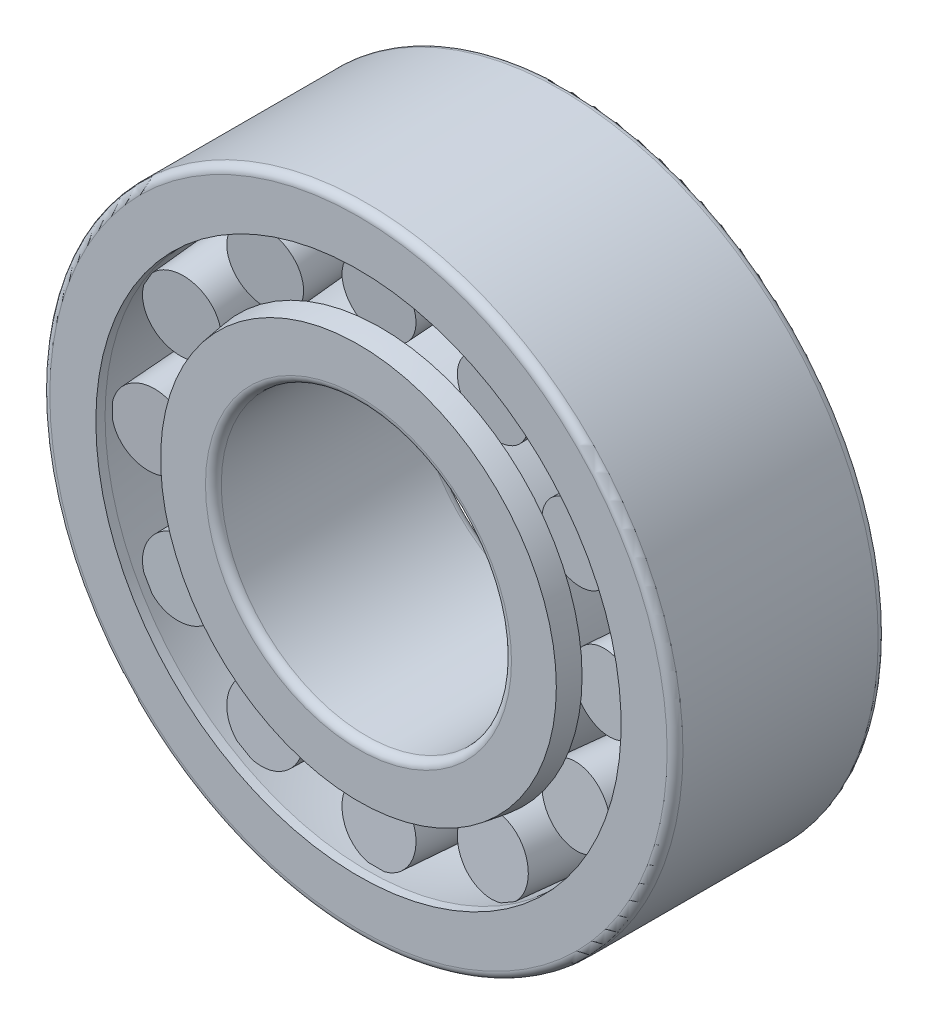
SolidWorks part; units mm, degrees
ref_plane "Front Plane" through (0, 0, 0) normal (0, 0, 1) x (1, 0, 0)
ref_plane "Top Plane" through (0, 0, 0) normal (0, 1, 0) x (1, 0, 0)
ref_plane "Right Plane" through (0, 0, 0) normal (1, 0, 0) x (0, 0, -1)
other "Configuration Table"
sketch "BaseSke" plane through (0, 0, 0) normal (1, 0, 0) x (0, 0, -1)
  line L0 (-47.2296, 0) -> (69.4868, 0) construction
  line L2 (0, 129.5214) -> (0, 102.0515) construction
  line L3 (-40, 55) -> (-40, 75) construction
  line L4 (-40, 120) -> (40, 120) construction
  line L5 (-40, 55) -> (40, 55) construction
  line L7 (40, 55) -> (40, 75) construction
  line L8 (40, 99) -> (40, 120) construction
  line L9 (-40, 99) -> (-40, 120) construction
  line L11 (0, 90.2041) -> (-40, 87) construction
  line L12 (0, 90.2041) -> (40, 87) construction
  line L13 (-40, 99) -> (-40, 75) construction
  line L14 (0, 78.3568) -> (0, -86.3012) construction
  line L15 (0, 102.0515) -> (0, 78.3568) construction
  line L16 (-32.2167, 86.2859) -> (-31.1, 72.3457) construction
  line L17 (-33.3333, 100.226) -> (-6.7518, 102.3553)
  line L18 (-33.3333, 100.226) -> (-32.2167, 86.2859)
  line L19 (-31.1, 72.3457) -> (-4.5185, 74.475) construction
  line L20 (-6.7518, 102.3553) -> (-5.6352, 88.4151)
  line L21 (-4.5185, 74.475) -> (-5.6352, 88.4151) construction
  line L22 (-32.2167, 86.2859) -> (-5.6352, 88.4151)
  line L23 (-40, 85.6624) -> (0, 88.8665) construction
  arc A1 (-40, 99) -> (40, 99) centre (0, -161.6432) cw construction
  arc A2 (40, 75) -> (-40, 75) centre (0, -161.6432) ccw construction
revolve "Roller" add sketch "BaseSke" angle 360 about L23
sketch "OuterRaceSke" plane through (0, 0, 0) normal (1, 0, 0) x (0, 0, -1)
  line L0 (0, 0) -> (0, 94.5438) construction
  line L1 (-40, 120) -> (40, 120)
  line L2 (-40, 120) -> (-40, 98.9798)
  line L3 (40, 120) -> (40, 98.9798)
  line L5 (-50.3916, 0) -> (55.2197, 0) construction
  arc A0 (-40, 98.9798) -> (40, 98.9798) centre (0, -161.6432) cw
  arc A2 (40, 99) -> (-40, 99) centre (0, -161.6432) ccw construction
  dimension "D1" = 0.02
revolve "OuterRace" add sketch "OuterRaceSke" angle 360 about L5
sketch "InnerRaceSke" plane through (0, 0, 0) normal (1, 0, 0) x (0, 0, -1)
  line L0 (-70.8626, 0) -> (113.5527, 0) construction
  line L1 (0, 90.393) -> (0, -90.393) construction
  line L2 (-40, 55) -> (40, 55)
  line L3 (-40, 55) -> (-40, 75)
  line L4 (-31.5154, 76.2786) -> (-31.2013, 72.3577)
  line L5 (-31.2013, 72.3577) -> (-4.4204, 74.5029)
  line L7 (-4.4204, 74.5029) -> (-4.7254, 78.3103)
  line L8 (-32.2167, 86.2859) -> (-31.1, 72.3457) construction
  line L9 (4.4204, 74.5029) -> (4.7254, 78.3103)
  line L10 (-4.5185, 74.475) -> (-5.6352, 88.4151) construction
  line L11 (-31.1, 72.3457) -> (-4.5185, 74.475) construction
  line L14 (31.2013, 72.3577) -> (4.4204, 74.5029)
  line L15 (31.5154, 76.2786) -> (31.2013, 72.3577)
  line L16 (40, 55) -> (40, 75)
  arc A0 (-40, 75) -> (-31.5154, 76.2786) centre (0, -161.6432) cw
  arc A1 (40, 75) -> (-40, 75) centre (0, -161.6432) ccw construction
  arc A2 (-4.7254, 78.3103) -> (4.7254, 78.3103) centre (0, -161.6432) cw
  arc A3 (40, 75) -> (31.5154, 76.2786) centre (0, -161.6432) ccw
  point P38 (0, 55)
  dimension "D2" = 0.1
  dimension "D1" = 0.02
  dimension "D3" = 0.1
revolve "InnerRace" add sketch "InnerRaceSke" angle 360 about L0
mirror "MirrorRoller" about plane through (0, 0, 0) normal (0, 0, 1) of "Roller"
fillet "Fillet1" radius 3 4 edges at (55, 0, 40) (120, 0, 40) (55, 0, -40) (120, 0, -40)
sketch "CutGrooveSke" plane through (0, 0, 0) normal (1, 0, 0) x (0, 0, -1)
  line L0 (-51.8407, 0) -> (83.8302, 0) construction
  line L1 (-20, -137.6) -> (-24, -137.6)
  line L2 (-20, -137.6) -> (-20, -117.6)
  line L3 (-20, -117.6) -> (-24, -117.6)
  line L4 (-24, -137.6) -> (-24, -117.6)
revolve "CutGroove" [suppressed] cut sketch "CutGrooveSke" angle 360 about L0
sketch "TaperSke" plane through (0, 0, 0) normal (1, 0, 0) x (0, 0, -1)
  line L0 (-40, 55) -> (40, 55)
  line L1 (40, 55) -> (40, 61.6667)
  line L2 (40, 61.6667) -> (-40, 55)
  line L7 (-41.2502, 0) -> (40.8606, 0) construction
revolve "Taper" [suppressed] cut sketch "TaperSke" angle 360 about L7
fillet "Fillet2" [suppressed] radius 3
pattern_circular "CirPatternBall" count 12 over 360 about axis through (0, 0, 0) along (0, 0, 1) of "Roller", "MirrorRoller"
sketch "SimplifiedSke" plane through (0, 0, 0) normal (1, 0, 0) x (0, 0, -1)
  line L0 (37.5911, 0) -> (-37.5911, 0) construction
  line L1 (0, 0) -> (0, 96.8272) construction
  line L2 (-31.1, 72.3457) -> (-4.5185, 74.475)
  line L3 (-31.1, 72.3457) -> (-33.3333, 100.226)
  line L4 (-33.3333, 100.226) -> (-6.7518, 102.3553)
  line L5 (-4.5185, 74.475) -> (-6.7518, 102.3553)
  line L7 (4.5185, 74.475) -> (6.7518, 102.3553)
  line L8 (31.1, 72.3457) -> (4.5185, 74.475)
  line L9 (31.1, 72.3457) -> (33.3333, 100.226)
  line L10 (33.3333, 100.226) -> (6.7518, 102.3553)
revolve "Simplified" [suppressed] add sketch "SimplifiedSke" angle 360 about L0
chamfer "Chamfer" distance 3.3333 angle 10 2 edges at (98.9798, 0, -40) (98.9798, 0, 40)
equation "\"D1@BaseSke\" = \"Bearing_Thickness@BaseSke\"*3"
equation "\"D2@BaseSke\" =  ( \"Bearing_Outside_Diameter@BaseSke\" - \"Bearing_Inside_Diameter@BaseSke\" ) /6.5"
equation "\"D3@BaseSke\" = \"D2@BaseSke\"*1.05"
equation "\"D4@BaseSke\" = \"Bearing_Thickness@BaseSke\"/3"
equation "\"D5@BaseSke\" = \"Bearing_Thickness@BaseSke\"/12"
equation "\"D6@BaseSke\" = \"Bearing_Thickness@BaseSke\"/60"
equation "\"D1@CutGrooveSke\" = \"Bearing_Outside_Diameter@BaseSke\" * 0.49"
equation "\"D2@CutGrooveSke\" = \"Bearing_Thickness@BaseSke\" *0.25"
equation "\"D3@CutGrooveSke\" = \"Bearing_Thickness@BaseSke\"/20"
equation "\"Taper@TaperSke\" = \"Bearing_Thickness@BaseSke\"/12"
equation "\"D1@Fillet2\" = \"Fillet_radius@Fillet1\""
equation "\"D1@CirPatternBall\" =  int(  ( \"Bearing_Outside_Diameter@BaseSke\" + \"Bearing_Inside_Diameter@BaseSke\" )  / 2 *  pi  /  ( \"Bearing_Outside_Diameter@BaseSke\" - \"Bearing_Inside_Diameter@BaseSke\" ) * 3 ) "
equation "\"D1@Chamfer\" = \"Bearing_Thickness@BaseSke\"/24"
